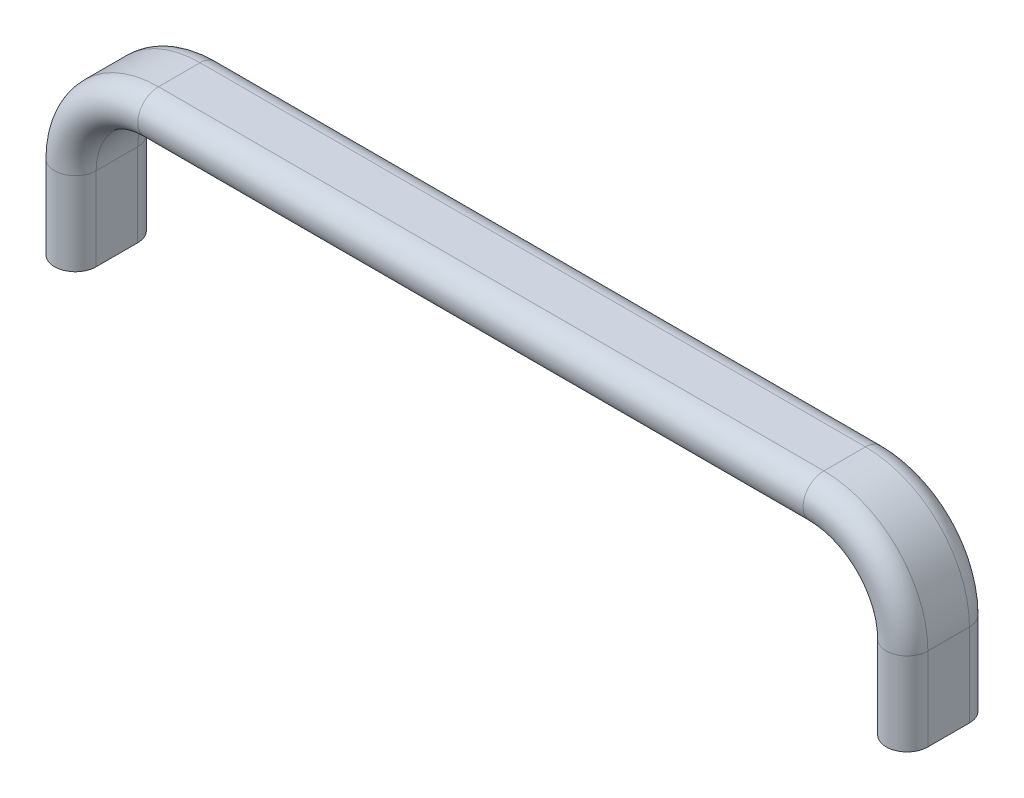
SolidWorks part; units mm, degrees
ref_plane "Front Plane" through (0, 0, 0) normal (0, 0, 1) x (1, 0, 0)
ref_plane "Top Plane" through (0, 0, 0) normal (0, 1, 0) x (1, 0, 0)
ref_plane "Right Plane" through (0, 0, 0) normal (1, 0, 0) x (0, 0, -1)
sketch "Sketch1" plane through (0, 0, 0) normal (0, 0, 1) x (1, 0, 0)
  line L0 (-100, 0) -> (-100, 20)
  line L1 (-80, 40) -> (80, 40)
  line L2 (0, 0) -> (0, 50000) construction
  line L3 (100, 0) -> (100, 20)
  arc A0 (-100, 20) -> (-80, 40) centre (-80, 20) cw
  arc A1 (100, 20) -> (80, 40) centre (80, 20) ccw
  point P9 (0, 40)
  dimension "D3" = 20
  dimension "D1" = 200
  dimension "D2" = 40
sketch "Sketch2" plane through (0, 0, 0) normal (0, 1, 0) x (1, 0, 0)
  line L0 (-105, -5) -> (-105, 5)
  line L1 (-95, 5) -> (-95, -5)
  line L2 (0, 0) -> (-50000, 0) construction
  line L3 (-100, -10) -> (-100, 10) construction
  arc A0 (-105, 5) -> (-95, 5) centre (-100, 5) cw
  arc A1 (-105, -5) -> (-95, -5) centre (-100, -5) ccw
  point P0 (-100, 10)
  point P6 (-105, 0)
  point P10 (-95, 0)
  point P11 (-100, -10)
  point P15 (-100, 0)
  dimension "D1" = 10
  dimension "D2" = 20
sweep "Sweep1" add profiles "Sketch2" path "Sketch1"
sketch "Sketch3" plane through (0, 0, 0) normal (0, -1, 0) x (1, 0, 0)
  circle A0 centre (-100, 0) radius 2.1
  dimension "D1" = 4.2
  dimension "D2" = 100
extrude "Extrude1" cut sketch "Sketch3" against normal blind 12.5
sketch "Sketch4" plane through (0, 0, 0) normal (0, -1, 0) x (1, 0, 0)
  circle A0 centre (-100, 0) radius 2.5
  dimension "D1" = 5
extrude "Extrude2" cut sketch "Sketch4" against normal blind 10
sketch "Sketch5" plane through (0, 0, 0) normal (0, 0, 1) x (1, 0, 0)
  line L0 (-100, 12.5) -> (-102.1, 12.5)
  line L1 (-102.1, 12.5) -> (-100, 13.7124)
  line L2 (-100, 13.7124) -> (-100, 12.5)
  dimension "D1" = 30
  dimension "D2" = 2.1
  dimension "D3" = 12.5
  dimension "D4" = 100
revolve "Cut-Revolve1" cut sketch "Sketch5" angle 360 about L2
mirror "Mirror1" about plane through (0, 0, 0) normal (1, 0, 0) of "Cut-Revolve1", "Extrude2", "Extrude1"
equation "\"D2@Sketch3\" = \"D1@Sketch1\"/2"
equation "\"D2@Sketch5\" = \"D1@Sketch3\"/2"
equation "\"D3@Sketch5\" = \"D1@Extrude1\""
equation "\"D4@Sketch5\" = \"D1@Sketch1\"/2"
